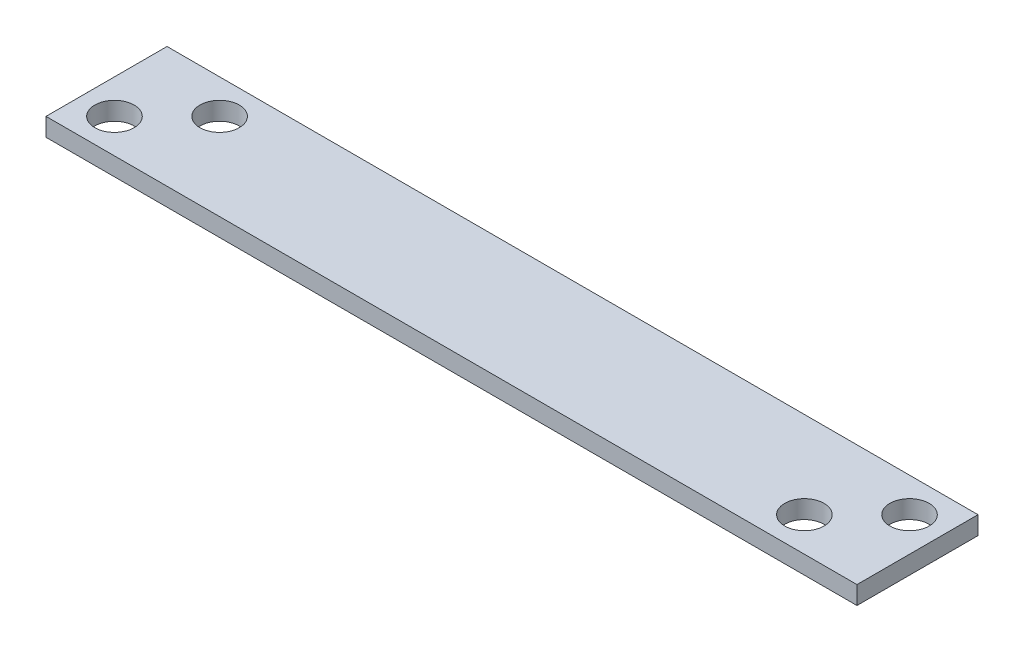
SolidWorks part; units mm, degrees
ref_plane "Front Plane" through (0, 0, 0) normal (0, 0, 1) x (1, 0, 0)
ref_plane "Top Plane" through (0, 0, 0) normal (0, 1, 0) x (1, 0, 0)
ref_plane "Right Plane" through (0, 0, 0) normal (1, 0, 0) x (0, 0, -1)
sketch "Sketch1" plane through (0, 0, 0) normal (0, 1, 0) x (1, 0, 0)
  line L0 (20, 20) -> (20, 0) construction
  line L1 (0, 0) -> (134, 0)
  line L2 (0, 0) -> (0, 20)
  line L3 (0, 20) -> (134, 20)
  line L4 (134, 0) -> (134, 20)
  line L5 (114, 20) -> (114, 0) construction
  line L7 (134, 20) -> (114, 0) construction
  line L8 (20, 20) -> (0, 0) construction
  circle A0 centre (128.3431, 14.3431) radius 3.25
  circle A1 centre (119.6569, 5.6569) radius 3.25
  circle A2 centre (14.3431, 14.3431) radius 3.25
  circle A3 centre (5.6569, 5.6569) radius 3.25
  dimension "D2" = 6.5
  dimension "D4" = 8
  dimension "D5" = 8
  dimension "D7" = 8
  dimension "D8" = 8
  dimension "D9" = 134
  dimension "D1" = 20
  dimension "D3" = 20
  dimension "D6" = 20
extrude "Extrude1" add sketch "Sketch1" along normal blind 3
